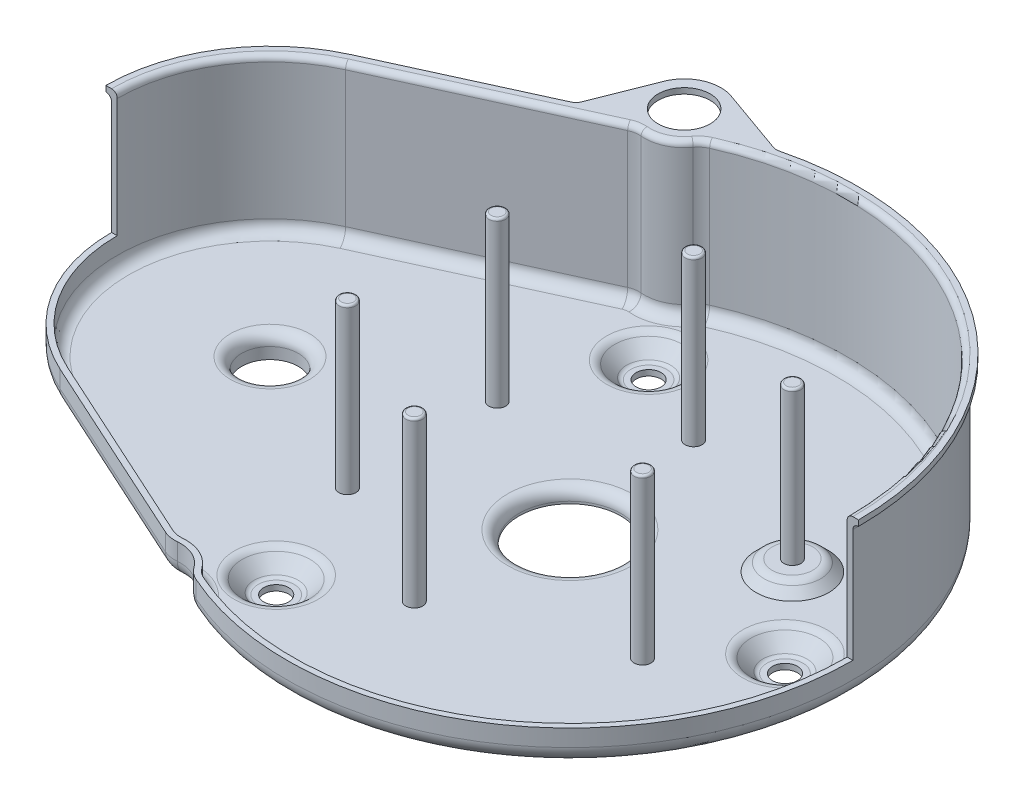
SolidWorks part; units mm, degrees
ref_plane "Face" through (0, 0, 0) normal (0, 0, 1) x (1, 0, 0)
ref_plane "Dessus" through (0, 0, 0) normal (0, 1, 0) x (1, 0, 0)
ref_plane "Droite" through (0, 0, 0) normal (1, 0, 0) x (0, 0, -1)
sketch "Esquisse1" plane through (0, 0, 0) normal (0, 1, 0) x (1, 0, 0)
  line L0 (-41.8709, 0) -> (47.7406, 0) construction
  line L1 (-32.3113, 12.7369) -> (-15.1934, 20.5471)
  line L2 (-32.3113, -12.7369) -> (-15.1934, -20.5471)
  line L3 (-12.2, 22.9129) -> (-12.2, -27.5878) construction
  arc A0 (-10.2157, -22.8175) -> (-10.2157, 22.8175) centre (0, 0) ccw
  arc A1 (-32.3113, 12.7369) -> (-32.3113, -12.7369) centre (-26.5, 0) ccw
  arc A2 (-13.9291, 20.7623) -> (-11.2228, 21.9968) centre (-13.6572, 23.75) ccw
  arc A3 (-11.2228, -21.9968) -> (-13.9291, -20.7623) centre (-13.6572, -23.75) ccw
  circle A4 centre (-26.5, 0) radius 27 construction
  arc A5 (-15.1934, 20.5471) -> (-13.9291, 20.7623) centre (-14.1557, 18.2726) cw
  arc A6 (-10.2157, 22.8175) -> (-11.2228, 21.9968) centre (-9.1942, 20.5358) ccw
  arc A7 (-15.1934, -20.5471) -> (-13.9291, -20.7623) centre (-14.1557, -18.2726) ccw
  arc A8 (-10.2157, -22.8175) -> (-11.2228, -21.9968) centre (-9.1942, -20.5358) cw
  dimension "D1" = 50
  dimension "D2" = 28
  dimension "D3" = 26.5
  dimension "D6" = 54
  dimension "D7" = 6
  dimension "D8" = 2.5
  dimension "D4" = 14.3
  dimension "D5" = 47.5
extrude "Base-Extrusion" add sketch "Esquisse1" against normal blind 14
sketch "Esquisse2" plane through (0, -14, 0) normal (0, -1, 0) x (1, 0, 0)
  line L0 (-2.7459, 0) -> (23.5, 0) construction
  circle A0 centre (0, 0) radius 19 construction
  circle A2 centre (19, 0) radius 3.5
  circle A3 centre (-9.5, -16.4545) radius 3.5
  circle A4 centre (-9.5, 16.4545) radius 3.5
  circle A5 centre (-26.5, 0) radius 3
  arc A6 (-32.3113, 12.7369) -> (-32.3113, -12.7369) centre (-26.5, 0) ccw construction
  dimension "D1" = 38
  dimension "D2" = 7
  dimension "D3" = 6
extrude "Boss.-Extru.1" add sketch "Esquisse2" along normal blind 1.5
sketch "Esquisse3" plane through (0, -14, 0) normal (0, -1, 0) x (1, 0, 0)
  circle A0 centre (13.04, -6.62) radius 2
  dimension "D3" = 4
  dimension "D1" = 6.62
  dimension "D2" = 13.04
extrude "Enlèv. mat.-Extru.1" cut sketch "Esquisse3" against normal blind 1
sketch "Esquisse4" plane through (0, -14, 0) normal (0, -1, 0) x (1, 0, 0)
  circle A0 centre (0, 0) radius 5
  dimension "D1" = 10
extrude "Boss.-Extru.2" add sketch "Esquisse4" along normal blind 0.7
chamfer "Chanfrein1" distance 1.5 angle 45 3 edges at (-9.5, -15.5, -19.9545) (-9.5, -15.5, 12.9545) (19, -15.5, -3.5)
chamfer "Chanfrein2" distance 1 angle 45 1 edges at (13.04, -14, -8.62)
fillet "Congé1" radius 1.5 10 edges at (-14.5753, -14, 20.7372) (-12.4122, -14, 21.0205) (-10.7735, -14, 22.4737) (25, -14, 0) (-10.7735, -14, -22.4737) (-12.4122, -14, -21.0205) (-14.5753, -14, -20.7372) (-23.7524, -14, -16.642) (-40.5, -14, 0) (-23.7524, -14, 16.642)
fillet "Congé2" radius 1 3 edges at (-9.5, -15.5, -18.4545) (-9.5, -15.5, 14.4545) (19, -15.5, -2)
fillet "Congé3" radius 0.5 7 edges at (-26.5, -14, 3) (19, -14, 3.5) (-9.5, -14, -12.9545) (-9.5, -14, 19.9545) (13.04, -13, -8.62) (0, -14, 5) (13.04, -14, -3.62)
shell "Coque1" thickness 0.5
sketch "Esquisse5" plane through (0, -15.5, 0) normal (0, -1, 0) x (1, 0, 0)
  circle A0 centre (-9.5, 16.4545) radius 1.1
  circle A1 centre (19, 0) radius 1.1
  circle A2 centre (-9.5, -16.4545) radius 1.1
  circle A3 centre (-9.5, 16.4545) radius 3.3536 construction
  circle A4 centre (19, 0) radius 3.3536 construction
  circle A5 centre (-9.5, -16.4545) radius 3.3536 construction
  dimension "D1" = 2.2
extrude "Enlèv. mat.-Extru.2" cut sketch "Esquisse5" against normal up to next
sketch "Esquisse6" plane through (0, 0, 0) normal (0, 1, 0) x (-1, 0, 0)
  line L0 (16.6813, -24.9405) -> (18.7037, -19.8034)
  line L1 (14.9859, -20.0922) -> (32.1038, -12.282)
  line L2 (32.1038, 12.282) -> (14.9859, 20.0922) construction
  line L3 (32.1038, 12.282) -> (14.9859, 20.0922)
  line L4 (32.5189, 13.1918) -> (19.2191, 19.2599)
  line L5 (19.2191, -19.2599) -> (32.5189, -13.1918)
  line L6 (34.0061, 0) -> (-43.191, 0) construction
  line L7 (12.5698, -26.8127) -> (6.7879, -24.7599)
  line L8 (12.5698, 26.8127) -> (6.7879, 24.7599)
  line L9 (16.6813, 24.9405) -> (18.7037, 19.8034)
  arc A0 (32.1038, -12.282) -> (32.1038, 12.282) centre (26.5, 0) ccw construction
  arc A1 (32.1038, -12.282) -> (32.1038, 12.282) centre (26.5, 0) ccw
  arc A2 (10.0114, 22.3612) -> (10.0114, -22.3612) centre (0, 0) ccw construction
  arc A3 (10.0114, 22.3612) -> (10.0114, -22.3612) centre (0, 0) ccw
  arc A4 (13.9744, -20.2644) -> (14.9859, -20.0922) centre (14.1557, -18.2726) ccw construction
  arc A5 (13.9744, -20.2644) -> (10.8171, -21.7046) centre (13.6572, -23.75) ccw construction
  arc A6 (10.0114, -22.3612) -> (10.8171, -21.7046) centre (9.1942, -20.5358) ccw construction
  arc A7 (13.9744, -20.2644) -> (14.9859, -20.0922) centre (14.1557, -18.2726) ccw
  arc A8 (13.9744, -20.2644) -> (10.8171, -21.7046) centre (13.6572, -23.75) ccw
  arc A9 (10.0114, -22.3612) -> (10.8171, -21.7046) centre (9.1942, -20.5358) ccw
  arc A10 (10.8171, 21.7046) -> (10.0114, 22.3612) centre (9.1942, 20.5358) ccw construction
  arc A11 (10.8171, 21.7046) -> (13.9744, 20.2644) centre (13.6572, 23.75) ccw construction
  arc A12 (14.9859, 20.0922) -> (13.9744, 20.2644) centre (14.1557, 18.2726) ccw construction
  arc A13 (10.8171, 21.7046) -> (10.0114, 22.3612) centre (9.1942, 20.5358) ccw
  arc A14 (10.8171, 21.7046) -> (13.9744, 20.2644) centre (13.6572, 23.75) ccw
  arc A15 (14.9859, 20.0922) -> (13.9744, 20.2644) centre (14.1557, 18.2726) ccw
  arc A16 (18.7037, -19.8034) -> (19.2191, -19.2599) centre (19.6342, -20.1697) cw
  arc A17 (6.7879, -24.7599) -> (6.2098, -24.7323) centre (6.4533, -25.7022) ccw
  arc A18 (6.2098, 24.7323) -> (6.2098, -24.7323) centre (0, 0) ccw
  arc A19 (18.7037, 19.8034) -> (19.2191, 19.2599) centre (19.6342, 20.1697) ccw
  arc A20 (6.7879, 24.7599) -> (6.2098, 24.7323) centre (6.4533, 25.7022) cw
  circle A21 centre (13.6572, -23.75) radius 2.3
  arc A22 (32.5189, -13.1918) -> (32.5189, 13.1918) centre (26.5, 0) ccw
  circle A23 centre (13.6572, 23.75) radius 2.3
  arc A24 (12.5698, -26.8127) -> (16.6813, -24.9405) centre (13.6572, -23.75) ccw
  arc A25 (16.6813, 24.9405) -> (12.5698, 26.8127) centre (13.6572, 23.75) ccw
  point P35 (6.5, -24.6577)
  dimension "D2" = 6.5
  dimension "D3" = 20
  dimension "D4" = 1
  dimension "D5" = 4.6
  dimension "D1" = 1
extrude "Boss.-Extru.3" add sketch "Esquisse6" against normal blind 0.5
fillet "Congé4" radius 0.5 20 edges at (-40, 0, 0) (-23.5448, 0, 16.1871) (-14.4914, 0, 20.2443) (-12.2047, 0, 20.5656) (-10.4577, 0, 22.0861) (24.5, 0, 0) (-10.4577, 0, -22.0861) (-12.2047, 0, -20.5656) (-14.4914, 0, -20.2443) (-23.5448, 0, -16.1871) (-23.7524, -0.5, -16.642) (-40.5, -0.5, 0) (-23.7524, -0.5, 16.642) (-14.5753, -0.5, 20.7372) (-12.4122, -0.5, 21.0205) (-10.7735, -0.5, 22.4737) (25, -0.5, 0) (-10.7735, -0.5, -22.4737) (-12.4122, -0.5, -21.0205) (-14.5753, -0.5, -20.7372)
sketch "Esquisse7" plane through (0, -13.5, 0) normal (0, 1, 0) x (-1, 0, 0)
  line L0 (32.1861, 0) -> (-27.6261, 0) construction
  line L1 (26.5, 0) -> (1.4103, 12.3397) construction
  line L2 (0, -14.8222) -> (0, 19.5105) construction
  circle A0 centre (26.5, 0) radius 2.5 construction
  circle A1 centre (26.5, 0) radius 2.5 construction
  circle A2 centre (-19, 0) radius 3 construction
  circle A3 centre (-19, 0) radius 3 construction
  circle A4 centre (26.5, 0) radius 27.96 construction
  circle A5 centre (0, 0) radius 12.42 construction
  circle A6 centre (-13.0398, -6.62) radius 0.75
  circle A7 centre (26.5, 0) radius 15 construction
  circle A8 centre (-13.0398, 6.62) radius 0.75
  circle A9 centre (1.4103, 12.3397) radius 0.75
  circle A10 centre (13.0398, 6.62) radius 0.75
  circle A11 centre (13.0398, -6.62) radius 0.75
  circle A12 centre (1.4103, -12.3397) radius 0.75
  point P13 (13.0398, 6.62)
  point P17 (-13.0398, 6.62)
  point P18 (13.0398, -6.62)
  point P19 (-13.0398, -6.62)
  point P20 (1.4103, 12.3397)
  point P21 (1.4103, -12.3397)
  dimension "D1" = 55.92
  dimension "D2" = 24.84
  dimension "D3" = 30
  dimension "D4" = 1.5
extrude "Boss.-Extru.4" add sketch "Esquisse7" along normal blind 14.5
fillet "Congé5" radius 0.2 6 edges at (-13.0398, 1, 7.37) (-13.0398, 1, -5.87) (-1.4103, 1, -11.5897) (13.0398, 1, -5.87) (13.0398, 1, 7.37) (-1.4103, 1, 13.0897)
sketch "Esquisse8" plane through (0, 0, 0) normal (0, 1, 0) x (1, 0, 0)
  line L0 (-41, 0) -> (-38.5, 0)
  line L1 (23, 0) -> (25.5, 0)
  line L4 (-31.4811, -10.9173) -> (-9.5472, -20.9249)
  line L7 (-19.2191, 19.2599) -> (-32.5189, 13.1918)
  line L8 (-32.5189, -13.1918) -> (-19.2191, -19.2599)
  line L9 (-18.7037, -19.8034) -> (-16.6813, -24.9405)
  line L10 (-12.5698, -26.8127) -> (-6.7879, -24.7599)
  line L11 (-6.7879, 24.7599) -> (-12.5698, 26.8127)
  line L12 (-16.6813, 24.9405) -> (-18.7037, 19.8034)
  line L14 (-32.5189, -13.1918) -> (-19.2191, -19.2599)
  line L15 (-18.7037, -19.8034) -> (-16.6813, -24.9405)
  line L16 (-12.5698, -26.8127) -> (-6.7879, -24.7599)
  arc A0 (-9.5472, -20.9249) -> (23, 0) centre (0, 0) ccw
  arc A4 (-38.5, 0) -> (-31.4811, -10.9173) centre (-26.5, 0) ccw
  arc A8 (-19.2191, 19.2599) -> (-18.7037, 19.8034) centre (-19.6342, 20.1697) ccw
  arc A9 (-32.5189, 13.1918) -> (-32.5189, -13.1918) centre (-26.5, 0) ccw
  arc A10 (-18.7037, -19.8034) -> (-19.2191, -19.2599) centre (-19.6342, -20.1697) ccw
  arc A11 (-16.6813, -24.9405) -> (-12.5698, -26.8127) centre (-13.6572, -23.75) ccw
  arc A12 (-6.2098, -24.7323) -> (-6.7879, -24.7599) centre (-6.4533, -25.7022) ccw
  arc A13 (-6.2098, -24.7323) -> (-6.2098, 24.7323) centre (0, 0) ccw
  arc A14 (-6.7879, 24.7599) -> (-6.2098, 24.7323) centre (-6.4533, 25.7022) ccw
  arc A15 (-12.5698, 26.8127) -> (-16.6813, 24.9405) centre (-13.6572, 23.75) ccw
  arc A17 (-41, 0) -> (-32.5189, -13.1918) centre (-26.5, 0) ccw
  arc A18 (-18.7037, -19.8034) -> (-19.2191, -19.2599) centre (-19.6342, -20.1697) ccw
  arc A19 (-16.6813, -24.9405) -> (-12.5698, -26.8127) centre (-13.6572, -23.75) ccw
  arc A20 (-6.2098, -24.7323) -> (-6.7879, -24.7599) centre (-6.4533, -25.7022) ccw
  arc A21 (-6.2098, -24.7323) -> (25.5, 0) centre (0, 0) ccw
  dimension "D1" = 0
  dimension "D2" = 2.5
extrude "COUPE" cut sketch "Esquisse8" against normal blind 11
